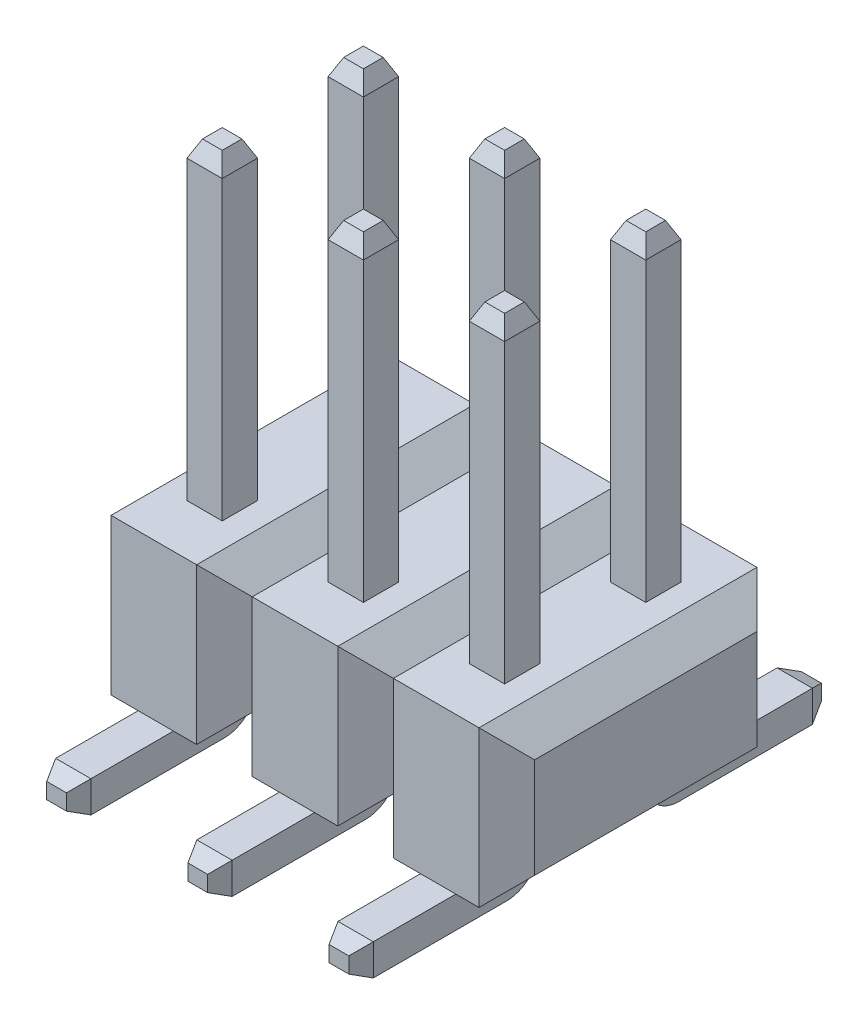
SolidWorks part; units mm, degrees
ref_plane "Front Plane" through (0, 0, 0) normal (0, 0, 1) x (1, 0, 0)
ref_plane "Top Plane" through (0, 0, 0) normal (0, 1, 0) x (1, 0, 0)
ref_plane "Right Plane" through (0, 0, 0) normal (1, 0, 0) x (0, 0, -1)
sketch "Sketch1" plane through (0, 0, 0) normal (0, 1, 0) x (1, 0, 0)
  line L1 (0, 0) -> (2.54, 0)
  line L2 (0, 0) -> (0, 5)
  line L3 (0, 5) -> (2.54, 5)
  line L4 (2.54, 0) -> (2.54, 5)
  dimension "D1" = 5
  dimension "D2" = 2.54
extrude "Boss-Extrude1" add sketch "Sketch1" along normal blind 2.8
chamfer "Chamfer1" distance 0.5 angle 45 8 edges at (2.54, 0, -2.5) (2.54, 1.4, -5) (2.54, 2.8, -2.5) (2.54, 1.4, 0) (0, 0, -2.5) (0, 1.4, 0) (0, 1.4, -5) (0, 2.8, -2.5)
pattern_linear "LPattern1" count 3 spacing 2.54 along (1, 0, 0)
sketch "Sketch2" plane through (0, 2.8, 0) normal (0, 1, 0) x (1, 0, 0)
  line L0 (1.27, 5) -> (1.27, 0) construction
  line L1 (0.9525, 4.0875) -> (1.5875, 4.0875)
  line L2 (0.9525, 4.0875) -> (0.9525, 3.4525)
  line L3 (0.9525, 3.4525) -> (1.5875, 3.4525)
  line L4 (1.5875, 4.0875) -> (1.5875, 3.4525)
  line L5 (2.04, 5) -> (0.5, 5) construction
  line L6 (0.5, 0) -> (2.04, 0) construction
  line L7 (1.5875, 3.77) -> (0.9525, 3.77) construction
  point P10 (1.27, 4.0875)
  point P13 (1.27, 3.77)
  point P14 (1.27, 2.5)
  dimension "D1" = 0.635
  dimension "D2" = 1.27
extrude "Boss-Extrude2" add sketch "Sketch2" along normal blind 5.635 and the other way up to surface (2.8 mm away) separate body
sketch "Sketch3" plane through (0.9525, 0, 0) normal (-1, 0, 0) x (0, 0, 1)
  line L0 (-2.5, 2.3) -> (-2.5, 1.0771) construction
  line L2 (-0.5, 2.3) -> (-4.5, 2.3) construction
  line L3 (0, 0) -> (-5, 0) construction
  line L4 (-5, 2.8) -> (0, 2.8) construction
  line L5 (-3.4525, 0) -> (-4.0875, 0)
  line L6 (-4.0525, -0.6) -> (-6.75, -0.6)
  line L7 (-6.75, -0.6) -> (-6.75, -0.035)
  line L8 (-4.0875, 0) -> (-4.0875, 8.435) construction
  line L9 (-4.0525, 0) -> (-4.0875, 0) construction
  line L10 (-4.1225, 0) -> (-4.0875, 0) construction
  line L11 (-4.1225, -0.035) -> (-6.75, -0.035)
  arc A0 (-3.4525, 0) -> (-4.0525, -0.6) centre (-4.0525, 0) cw
  arc A1 (-4.0875, 0) -> (-4.1225, -0.035) centre (-4.1225, 0) cw
  point P1 (-2.5, 2.3)
  dimension "D1" = 3.4
  dimension "D2" = 4.25
extrude "Boss-Extrude3" add sketch "Sketch3" against normal blind 0.635 separate body
combine bodies "Combine1" operation type add bodies to combine 104 105
chamfer "Chamfer2" distance 0.3 angle 25 8 edges at (1.27, -0.035, -6.75) (0.9525, -0.3175, -6.75) (1.5875, -0.3175, -6.75) (1.27, -0.6, -6.75) (1.5875, 8.435, -3.77) (1.27, 8.435, -3.4525) (0.9525, 8.435, -3.77) (1.27, 8.435, -4.0875)
ref_plane "Plane4" through (0, 0, -2.5) normal (0, 0, -1) x (-1, 0, 0)
mirror "Mirror1" about plane through (0, 0, -2.5) normal (0, 0, -1)
pattern_linear "LPattern3" count 3 spacing 2.54 along (1, 0, 0)
